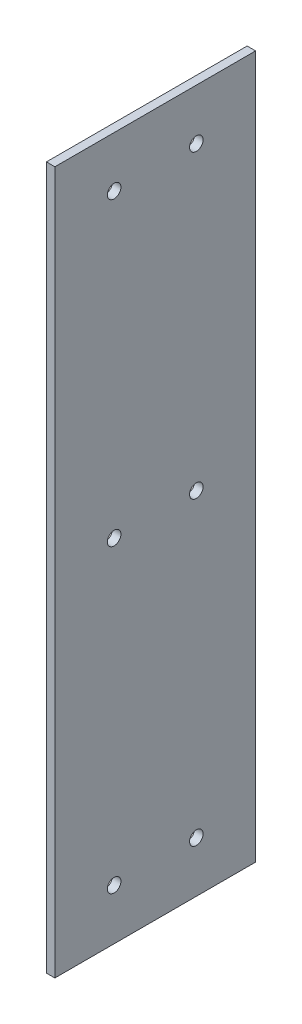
SolidWorks part; units mm, degrees
ref_plane "Plan de face" through (0, 0, 0) normal (0, 0, 1) x (1, 0, 0)
ref_plane "Plan de dessus" through (0, 0, 0) normal (0, 1, 0) x (1, 0, 0)
ref_plane "Plan de droite" through (0, 0, 0) normal (1, 0, 0) x (0, 0, -1)
ref_plane "Plan1" through (0, 0, 0) normal (1, 0, 0) x (0, 0, -1)
sketch "Esquisse22" plane through (0, 0, 0) normal (1, 0, 0) x (0, 0, -1)
  line L6 (-2944.9971, -0.18) -> (-2944.9971, -830)
  line L7 (-2944.9971, -830) -> (-2707.8991, -830)
  line L10 (-2707.8991, -830) -> (-2707.8991, -0.18)
  line L11 (-2707.8991, -0.18) -> (-2944.9971, -0.18)
  circle A6 centre (-2875, -770) radius 8
  circle A7 centre (-2777.9, -770) radius 8
  circle A8 centre (-2777.9, -415) radius 8
  circle A9 centre (-2875, -415) radius 8
  circle A10 centre (-2875, -60) radius 8
  circle A11 centre (-2777.9, -60) radius 8
extrude "Boss.-Extru.1" add sketch "Esquisse22" along normal blind 10
